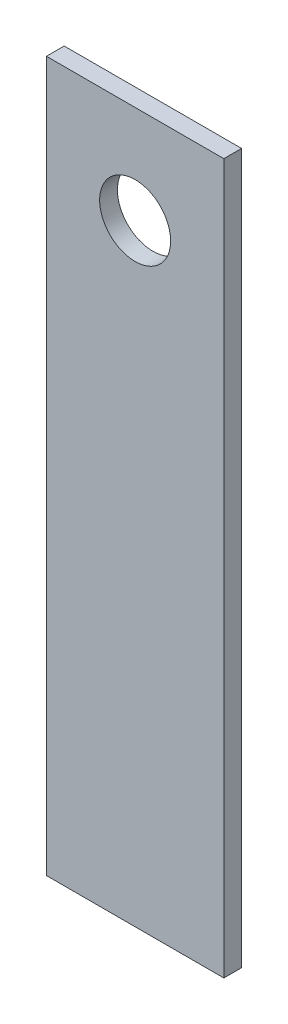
SolidWorks part; units mm, degrees
ref_plane "Ebene vorne" through (0, 0, 0) normal (0, 0, 1) x (1, 0, 0)
ref_plane "Ebene oben" through (0, 0, 0) normal (0, 1, 0) x (1, 0, 0)
ref_plane "Ebene rechts" through (0, 0, 0) normal (1, 0, 0) x (0, 0, -1)
sketch "Skizze1" plane through (0, 0, 0) normal (0, 0, 1) x (1, 0, 0)
  line L1 (50, -200) -> (-50, -200)
  line L2 (50, -200) -> (50, 200)
  line L3 (50, 200) -> (-50, 200)
  line L4 (-50, -200) -> (-50, 200)
  line L5 (50, -200) -> (-50, 200) construction
  line L6 (50, 200) -> (-50, -200) construction
  circle A0 centre (0, 144.7849) radius 20
  point P0 (0, 0)
  dimension "D3" = 40
  dimension "D1" = 400
  dimension "D2" = 100
extrude "Linear austragen1" add sketch "Skizze1" along normal blind 10
